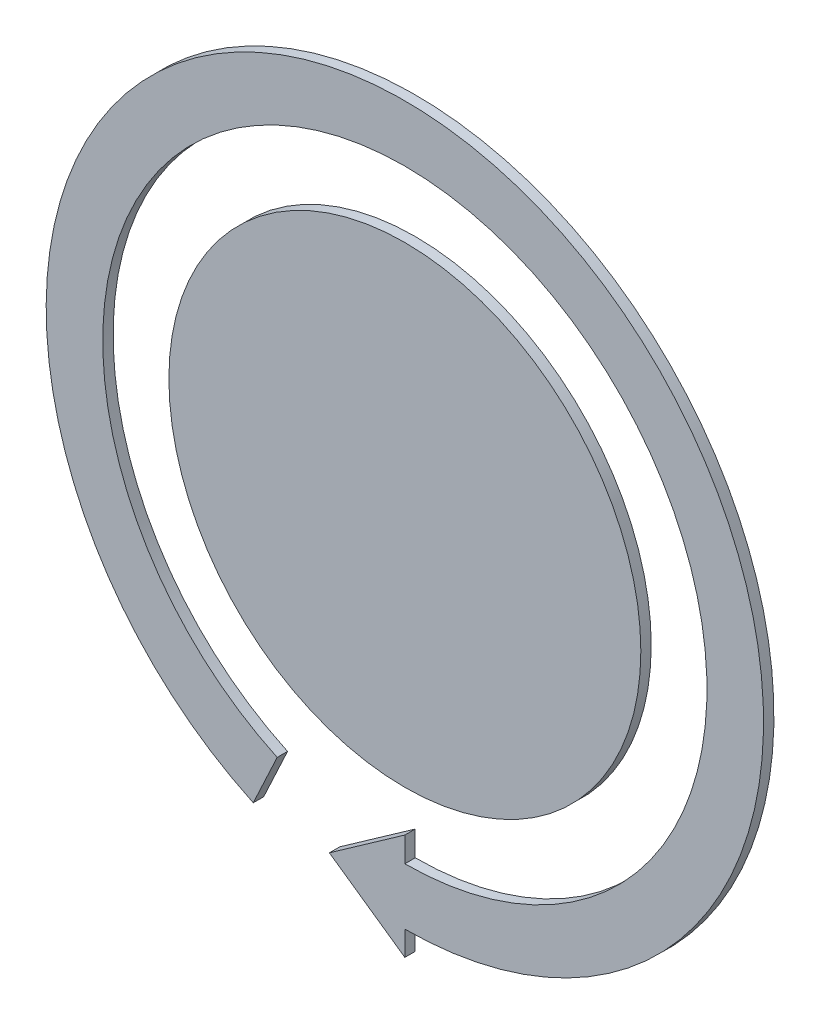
SolidWorks part; units mm, degrees
ref_plane "Ebene vorne" through (0, 0, 0) normal (0, 0, 1) x (1, 0, 0)
ref_plane "Ebene oben" through (0, 0, 0) normal (0, 1, 0) x (1, 0, 0)
ref_plane "Ebene rechts" through (0, 0, 0) normal (1, 0, 0) x (0, 0, -1)
sketch "Skizze3" plane through (0, 0, 0) normal (0, 0, 1) x (-1, 0, 0)
  line L0 (14.8694, 65.0728) -> (16.206, 70.922) construction
  line L1 (0, 0) -> (2.1131, 4.5315) construction
  line L2 (16.206, 70.922) -> (18.1774, 79.5496) construction
  line L3 (0, 0) -> (0, 5) construction
  line L4 (0, 0) -> (1.1138, 4.8744) construction
  line L5 (0, 92.275) -> (18.1774, 79.5496)
  line L6 (18.1774, 79.5496) -> (0, 66.75)
  line L7 (0, 72.75) -> (0, 86.375) construction
  line L8 (0, 86.375) -> (0, 92.275)
  line L9 (0, 5) -> (0, 56.825) construction
  line L10 (0, 66.75) -> (0, 72.75)
  line L11 (1.1138, 4.8744) -> (12.6585, 55.3971) construction
  line L12 (12.6585, 55.3971) -> (14.8694, 65.0728) construction
  line L13 (2.1131, 4.5315) -> (24.0153, 51.5009) construction
  line L14 (30.7455, 65.9339) -> (36.5037, 78.2823)
  line L15 (0, 56.825) -> (0, 66.75) construction
  line L16 (24.0153, 51.5009) -> (28.2098, 60.496) construction
  line L17 (28.2098, 60.496) -> (30.7455, 65.9339) construction
  arc A0 (36.5037, 78.2823) -> (9.117, 85.8925) centre (0, 0) ccw construction
  circle A2 centre (0, 0) radius 56.825
  arc A3 (0, 72.75) -> (30.7455, 65.9339) centre (0, 0) ccw
  arc A4 (0, 86.375) -> (36.5037, 78.2823) centre (0, 0) ccw
  arc A5 (0, 66.75) -> (28.2098, 60.496) centre (0, 0) ccw construction
  circle A6 centre (0, 0) radius 92.275 construction
  arc A7 (30.7455, 65.9339) -> (16.206, 70.922) centre (0, 0) ccw construction
  arc A8 (16.206, 70.922) -> (7.9086, 72.3189) centre (0, 0) ccw construction
  arc A9 (9.117, 85.8925) -> (0, 86.375) centre (0, 0) ccw construction
  arc A10 (7.9086, 72.3189) -> (0, 72.75) centre (0, 0) ccw construction
  arc A13 (14.8694, 65.0728) -> (0, 66.75) centre (0, 0) ccw construction
  arc A14 (28.2098, 60.496) -> (14.8694, 65.0728) centre (0, 0) ccw construction
  point P3 (0, 0)
  point P5 (0, 0)
  dimension "D2" = 172.75
  dimension "D3" = 145.5
  dimension "D4" = 113.65
  dimension "D5" = 133.5
  dimension "D6" = 81.6
  dimension "D1" = 184.55
  dimension "D7" = 25
  dimension "D8" = 12.129
extrude "Aufsatz-Linear austragen1" add sketch "Skizze3" along normal blind 2.5
